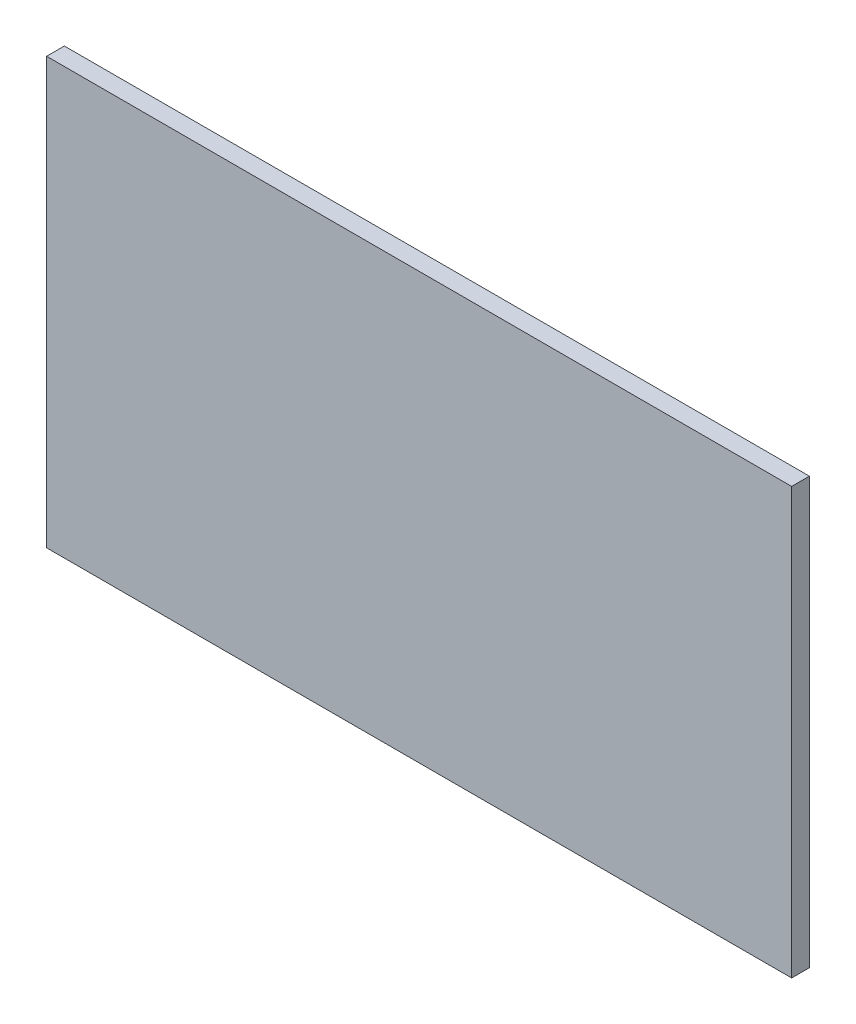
SolidWorks part; units mm, degrees
ref_plane "Front Plane" through (0, 0, 0) normal (0, 0, 1) x (1, 0, 0)
ref_plane "Top Plane" through (0, 0, 0) normal (0, 1, 0) x (1, 0, 0)
ref_plane "Right Plane" through (0, 0, 0) normal (1, 0, 0) x (0, 0, -1)
sketch "Sketch1" plane through (0, 0, 0) normal (0, 0, 1) x (1, 0, 0)
  line L1 (-133.35, -76.2) -> (133.35, -76.2)
  line L2 (-133.35, -76.2) -> (-133.35, 76.2)
  line L3 (-133.35, 76.2) -> (133.35, 76.2)
  line L4 (133.35, -76.2) -> (133.35, 76.2)
  line L5 (-133.35, -76.2) -> (133.35, 76.2) construction
  line L6 (-133.35, 76.2) -> (133.35, -76.2) construction
  point P0 (0, 0)
  dimension "D1" = 152.4
  dimension "D2" = 266.7
extrude "Boss-Extrude1" add sketch "Sketch1" along normal blind 6.35
